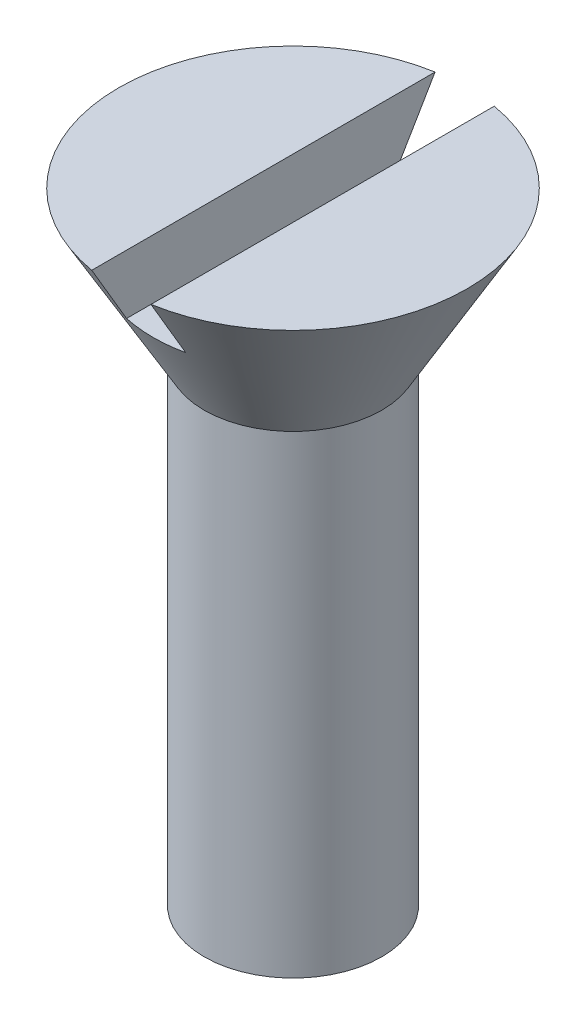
SolidWorks part; units mm, degrees
ref_plane "Front Plane" through (0, 0, 0) normal (0, 0, 1) x (1, 0, 0)
ref_plane "Top Plane" through (0, 0, 0) normal (0, 1, 0) x (1, 0, 0)
ref_plane "Right Plane" through (0, 0, 0) normal (1, 0, 0) x (0, 0, -1)
sketch "Sketch2" plane through (0, 0, 0) normal (0, 1, 0) x (1, 0, 0)
  circle A0 centre (0, 0) radius 3
  dimension "D1" = 6
extrude "Boss-Extrude1" add sketch "Sketch2" along normal blind 16
sketch "Sketch3" plane through (0, 16, 0) normal (0, 1, 0) x (1, 0, 0)
  circle A1 centre (0, 0) radius 3
  circle A2 centre (0, 0) radius 3
  dimension "D1" = 0
extrude "Boss-Extrude2" add sketch "Sketch3" along normal blind 5 draft 30
sketch "Sketch4" plane through (0, 0, 0) normal (0, -1, 0) x (1, 0, 0)
  circle A1 centre (0, 0) radius 3
  circle A2 centre (0, 0) radius 3
  dimension "D1" = 0
extrude "Boss-Extrude3" add sketch "Sketch4" along normal blind 5 draft 60
sketch "Sketch5" plane through (0, 21, 0) normal (0, 1, 0) x (1, 0, 0)
  line L1 (-1, -6.7568) -> (1, -6.7568)
  line L2 (-1, -6.7568) -> (-1, 6.7568)
  line L3 (-1, 6.7568) -> (1, 6.7568)
  line L4 (1, -6.7568) -> (1, 6.7568)
  line L5 (-1, -6.7568) -> (1, 6.7568) construction
  line L6 (-1, 6.7568) -> (1, -6.7568) construction
  point P0 (0, 0)
  dimension "D1" = 2
extrude "Cut-Extrude1" cut sketch "Sketch5" against normal blind 2
